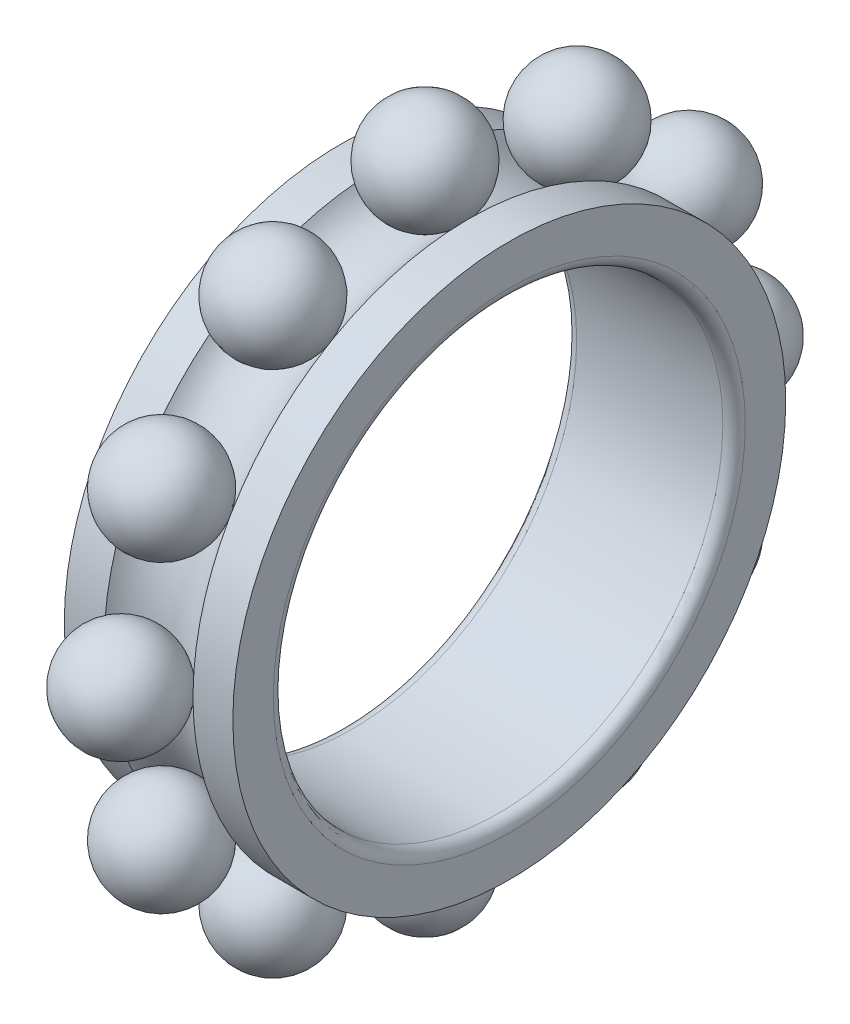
SolidWorks part; units mm, degrees
ref_plane "Face" through (0, 0, 0) normal (0, 0, 1) x (1, 0, 0)
ref_plane "Dessus" through (0, 0, 0) normal (0, 1, 0) x (1, 0, 0)
ref_plane "Droite" through (0, 0, 0) normal (1, 0, 0) x (0, 0, -1)
imported_body "Importée1"
ref_plane "Plan1" through (7.5, 0, 0) normal (1, 0, 0) x (0, 0, -1)
sketch "Esquisse1" plane through (7.5, 0, 0) normal (1, 0, 0) x (0, 0, -1)
  line L0 (0, 22.4) -> (0, 31.74)
  line L1 (0, 0) -> (0, 10) construction
  arc A0 (0, 31.74) -> (0, 22.4) centre (0, 27.07) ccw
  dimension "D2" = 9.34
  dimension "D1" = 27.07
revolve "Boss.-Révol.1" add sketch "Esquisse1" angle 360 about L1
pattern_circular "Répétition circulaire1" count 12 over 360
